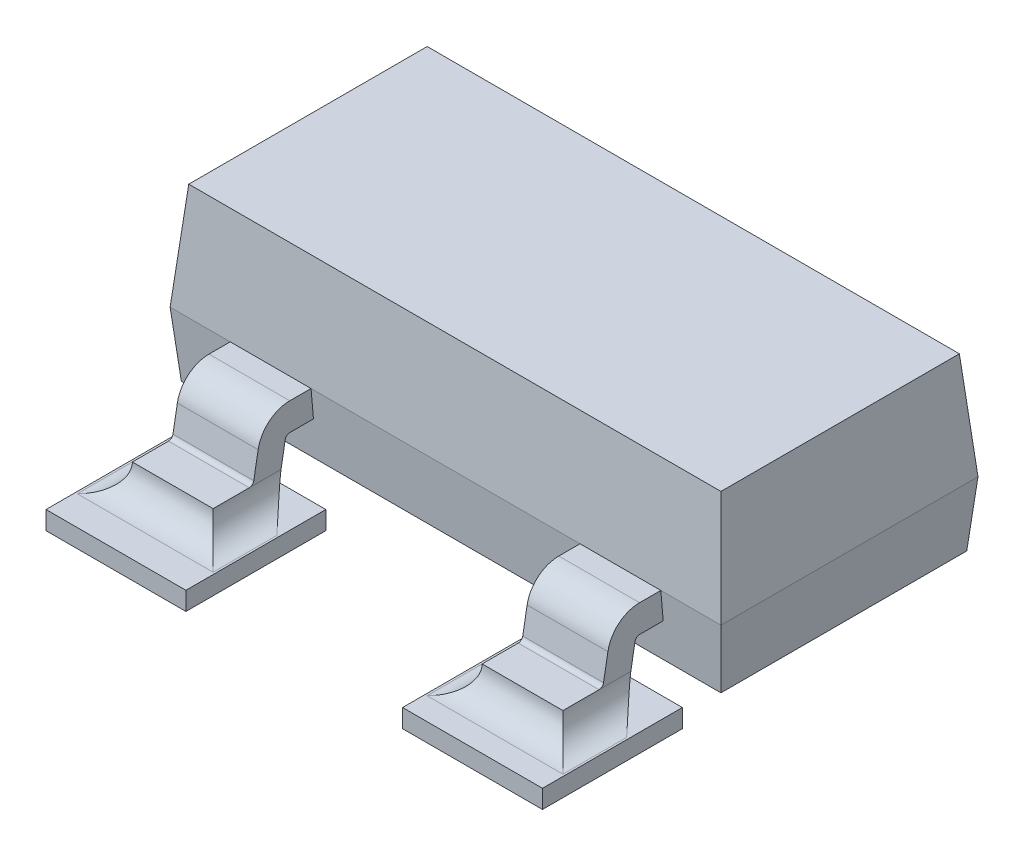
SolidWorks part; units mm, degrees
ref_plane "Front Plane" through (0, 0, 0) normal (0, 0, 1) x (1, 0, 0)
ref_plane "Top Plane" through (0, 0, 0) normal (0, 1, 0) x (1, 0, 0)
ref_plane "Right Plane" through (0, 0, 0) normal (1, 0, 0) x (0, 0, -1)
sketch "Sketch1" plane through (0, 0, 0) normal (1, 0, 0) x (0, 0, -1)
  line L0 (0.6694, 0.2) -> (-0.6694, 0.2)
  line L1 (-0.6694, 0.2) -> (-0.7, 0.55)
  line L2 (-0.7, 0.55) -> (-0.6493, 1.13)
  line L3 (-0.6493, 1.13) -> (0.6493, 1.13)
  line L4 (0.6493, 1.13) -> (0.7, 0.55)
  line L5 (0.7, 0.55) -> (0.6694, 0.2)
  line L6 (0.7, 0.55) -> (-0.7, 0.55) construction
  line L7 (0, 55) -> (0, -55) construction
  line L8 (55, 0) -> (-55, 0) construction
  dimension "D1" = 0.35
  dimension "D2" = 0.93
  dimension "D3" = 1.4
  dimension "D4" = 0.7
  dimension "D5" = 5
  dimension "D6" = 5
  dimension "D7" = 0.2
extrude "Boss-Extrude1" add sketch "Sketch1" along normal mid plane 3
sketch "Sketch2" plane through (0, 0, 0) normal (0, 0, 1) x (1, 0, 0)
  line L0 (-1.5, 0.55) -> (-1.4493, 1.13)
  line L1 (1.5, 1.13) -> (-1.5, 1.13) construction
  line L2 (-1.4493, 1.13) -> (-2, 1.13)
  line L3 (-2, 1.13) -> (-2, 0)
  line L4 (55, 0) -> (-55, 0) construction
  line L5 (-2, 0) -> (-1.4519, 0)
  line L6 (-1.4519, 0) -> (-1.5, 0.55)
  line L7 (1.4493, 1.13) -> (2, 1.13)
  line L8 (2, 1.13) -> (2, 0)
  line L9 (2, 0) -> (1.4519, 0)
  line L10 (1.4519, 0) -> (1.5, 0.55)
  line L11 (1.5, 0.55) -> (1.4493, 1.13)
  line L12 (0, -0.5115) -> (0, 0.5115) construction
  dimension "D1" = 5
  dimension "D2" = 5
  dimension "D3" = 2
  dimension "D4" = 2
extrude "Cut-Extrude1" cut sketch "Sketch2" against normal through all and the other way through all
ref_plane "Plane1" through (0.9525, 0, 0) normal (1, 0, 0) x (0, 0, -1)
sketch "Sketch3" plane through (0, 0, 0) normal (1, 0, 0) x (0, 0, -1)
  line L0 (0.5, 0.475) -> (0.8158, 0.475)
  line L1 (0.9242, 0.3841) -> (0.945, 0.2659)
  line L2 (1.0533, 0.175) -> (1.25, 0.175)
  line L3 (0, 0.5115) -> (0, -0.5115) construction
  line L4 (0.77, 0) -> (-0.77, 0) construction
  line L6 (0.7, 0.55) -> (-0.7, 0.55) construction
  arc A0 (0.945, 0.2659) -> (1.0533, 0.175) centre (1.0533, 0.285) ccw
  arc A1 (0.8158, 0.475) -> (0.9242, 0.3841) centre (0.8158, 0.365) cw
  dimension "D7" = 0.11
  dimension "D1" = 1.25
  dimension "D2" = 0.175
  dimension "D3" = 0.475
  dimension "D4" = 0.075
  dimension "D5" = 0.5
  dimension "D6" = 10
  dimension "D8" = 0.305
extrude "Extrude-Thin1" add sketch "Sketch3" along normal mid plane 0.44 thin
sketch "Sketch4" plane through (0.9525, 0, 0) normal (1, 0, 0) x (0, 0, -1)
  line L0 (-0.5, 0.475) -> (-0.8158, 0.475)
  line L1 (-0.9143, 0.3924) -> (-0.9381, 0.2576)
  line L2 (-1.0365, 0.175) -> (-1.2332, 0.175)
  line L3 (0, 0.5115) -> (0, -0.5115) construction
  line L4 (0.5, 0.475) -> (0.8158, 0.475) construction
  line L5 (1.0533, 0.175) -> (1.25, 0.175) construction
  arc A0 (-0.8158, 0.475) -> (-0.9143, 0.3924) centre (-0.8158, 0.375) ccw
  arc A1 (-0.9381, 0.2576) -> (-1.0365, 0.175) centre (-1.0365, 0.275) cw
  dimension "D3" = 0.1
  dimension "D1" = 10
  dimension "D2" = 0.5
extrude "Extrude-Thin2" add sketch "Sketch4" along normal mid plane 0.44 thin
pattern_linear "LPattern1" count 2 spacing 1.905 along (-1, 0, 0) of "Extrude-Thin2"
sketch "Sketch5" plane through (0, 0, 0) normal (0, 1, 0) x (1, 0, 0)
  line L0 (0, -0.5115) -> (0, 0.5115) construction
  line L1 (-0.381, 1.5425) -> (0.381, 1.5425)
  line L2 (-0.381, 1.5425) -> (-0.381, 0.7805)
  line L3 (-0.381, 0.7805) -> (0.381, 0.7805)
  line L4 (0.381, 1.5425) -> (0.381, 0.7805)
  line L5 (-1.3335, -0.7805) -> (-0.5715, -0.7805)
  line L6 (-1.3335, -0.7805) -> (-1.3335, -1.5425)
  line L7 (-1.3335, -1.5425) -> (-0.5715, -1.5425)
  line L8 (-0.5715, -0.7805) -> (-0.5715, -1.5425)
  line L9 (0.5715, -0.7435) -> (1.3335, -0.7435)
  line L10 (0.5715, -0.7435) -> (0.5715, -1.5055)
  line L11 (0.5715, -1.5055) -> (1.3335, -1.5055)
  line L12 (1.3335, -0.7435) -> (1.3335, -1.5055)
  line L14 (-0.6215, 0) -> (0.6215, 0) construction
extrude "Boss-Extrude2" add sketch "Sketch5" along normal blind 0.1
fillet "Fillet1" radius 0.15 9 edges at (0.22, 0.1, -1.1517) (0, 0.1, -1.25) (-0.22, 0.1, -1.1517) (1.1725, 0.1, 1.1349) (-0.7325, 0.1, 1.1349) (0.9525, 0.1, 1.2332) (0.7325, 0.1, 1.1349) (-0.9525, 0.1, 1.2332) (-1.1725, 0.1, 1.1349)
equation "\"D7@Sketch5\"=\"D6@Sketch5\""
